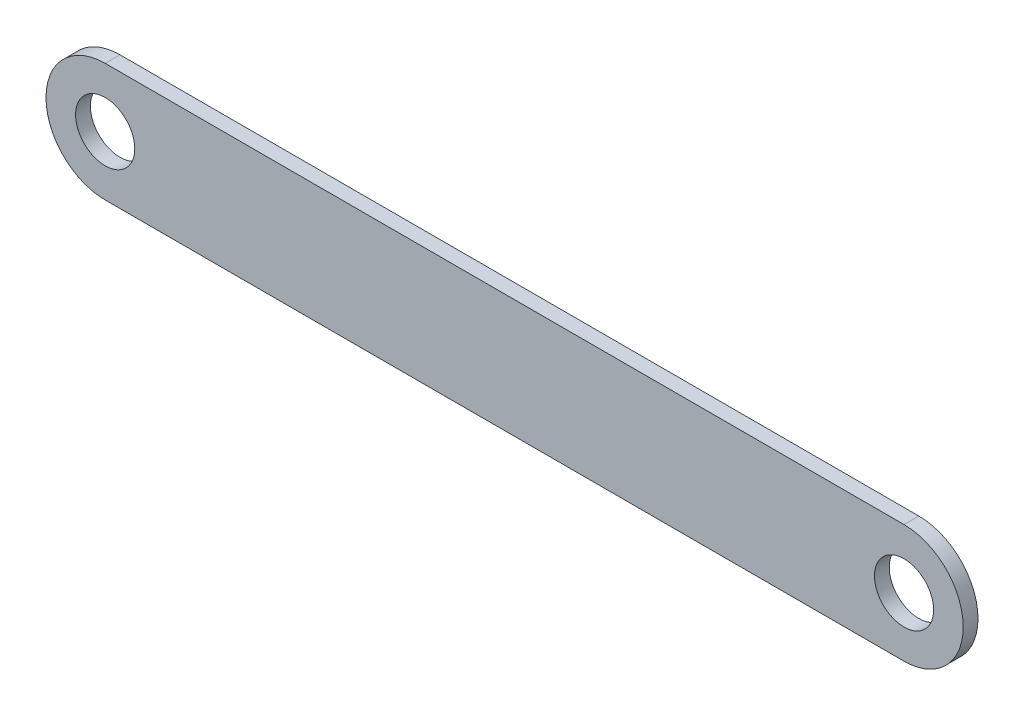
SolidWorks part; units mm, degrees
ref_plane "Front Plane" through (0, 0, 0) normal (0, 0, 1) x (1, 0, 0)
ref_plane "Top Plane" through (0, 0, 0) normal (0, 1, 0) x (1, 0, 0)
ref_plane "Right Plane" through (0, 0, 0) normal (1, 0, 0) x (0, 0, -1)
sketch "Sketch1" plane through (0, 0, 0) normal (0, 0, 1) x (1, 0, 0)
  line L0 (135, 20) -> (-135, 20)
  line L1 (-135, -20) -> (135, -20)
  line L2 (-135, 0) -> (135, 0) construction
  arc A0 (135, -20) -> (135, 20) centre (135, 0) ccw
  arc A1 (-135, 20) -> (-135, -20) centre (-135, 0) ccw
  point P6 (0, 0)
  dimension "D2" = 20
  dimension "D1" = 270
extrude "Boss-Extrude1" add sketch "Sketch1" along normal blind 5
sketch "Sketch2" plane through (0, 0, 5) normal (0, 0, 1) x (1, 0, 0)
  circle A0 centre (-135, 0) radius 10
  circle A1 centre (135, 0) radius 10
  dimension "D1" = 20
extrude "Cut-Extrude1" cut sketch "Sketch2" against normal through all
